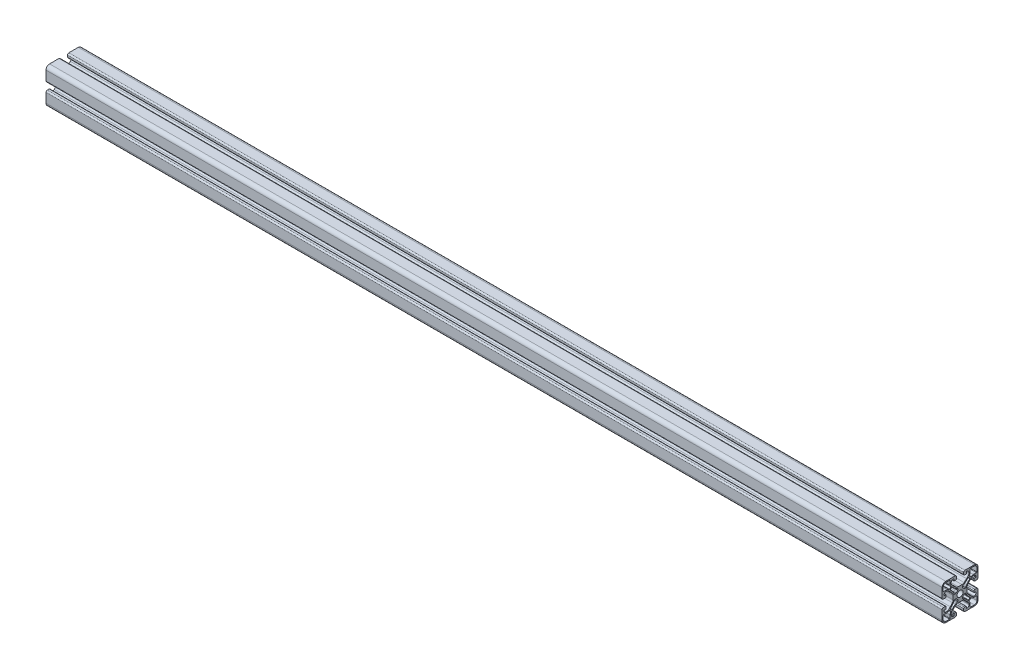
SolidWorks part; units mm, degrees
ref_plane "Ebene vorne" through (0, 0, 0) normal (0, 0, 1) x (1, 0, 0)
ref_plane "Ebene oben" through (0, 0, 0) normal (0, 1, 0) x (1, 0, 0)
ref_plane "Ebene rechts" through (0, 0, 0) normal (1, 0, 0) x (0, 0, -1)
sketch "Skizze1" plane through (0, 0, 0) normal (0, 1, 0) x (1, 0, 0)
  line L0 (0, 0) -> (1000, 0)
  dimension "D1" = 1000
other "Strukturbauteil1"
ref_plane "Ebene1" through (0, 0, 0) normal (1, 0, 0) x (0, 0, -1)
sketch "Model" plane through (0, 0, 0) normal (1, 0, 0) x (0, 0, -1)
  line L1 (0, 20) -> (-20, 20) construction
  line L2 (-20, 20) -> (-20, 0) construction
  line L4 (14.7836, 10) -> (15.5, 10)
  line L5 (17.59, 7) -> (16, 7)
  line L6 (15.5, 6.5) -> (15.5, 5)
  line L7 (16.5, 4) -> (18.5, 4)
  line L8 (20, 5.5) -> (20, 16)
  line L9 (16, 20) -> (5.5, 20)
  line L10 (4, 18.5) -> (4, 16.5)
  line L11 (5, 15.5) -> (6.5, 15.5)
  line L12 (7, 16) -> (7, 17.59)
  line L13 (10, 15.5) -> (10, 14.7836)
  line L14 (6.119, 2.5) -> (4.6098, 2.5)
  line L15 (9.5499, 10.8148) -> (10.8148, 9.5499)
  line L16 (18.8, 16) -> (18.8, 11.7)
  line L17 (18.3, 11.2) -> (14.7836, 11.2)
  line L18 (12.8543, 10.553) -> (12.4466, 10.2386)
  line L19 (11.7838, 10.2779) -> (10.2779, 11.7838)
  line L20 (10.553, 12.8543) -> (10.2386, 12.4466)
  line L21 (11.2, 14.7836) -> (11.2, 18.3)
  line L22 (11.7, 18.8) -> (16, 18.8)
  line L23 (18, 7.5) -> (18, 7.41)
  line L24 (13.5778, 9.5957) -> (10.8702, 7.2249)
  line L25 (10.8702, 7.2249) -> (8.531, 4.4899)
  line L26 (7.5, 18) -> (7.41, 18)
  line L27 (8.8303, 10.8019) -> (7.0915, 9.0992)
  line L28 (-10, 14.7836) -> (-10, 15.5)
  line L29 (-7, 17.59) -> (-7, 16)
  line L30 (-6.5, 15.5) -> (-5, 15.5)
  line L31 (-4, 16.5) -> (-4, 18.5)
  line L32 (-5.5, 20) -> (-16, 20)
  line L33 (-20, 16) -> (-20, 5.5)
  line L34 (-18.5, 4) -> (-16.5, 4)
  line L35 (-15.5, 5) -> (-15.5, 6.5)
  line L36 (-16, 7) -> (-17.59, 7)
  line L37 (-15.5, 10) -> (-14.7836, 10)
  line L38 (7.0915, 9.0992) -> (5.2023, 7.5652)
  line L39 (10.8019, 8.8303) -> (9.0992, 7.0915)
  line L40 (9.0992, 7.0915) -> (7.5652, 5.2023)
  line L41 (5.2023, 7.5652) -> (4.1197, 6.9517)
  line L42 (7.5652, 5.2023) -> (6.9517, 4.1197)
  line L43 (6.9517, 4.1197) -> (6.613, 2.9224)
  line L44 (9.5957, 13.5778) -> (7.2249, 10.8702)
  line L45 (7.2249, 10.8702) -> (4.4899, 8.531)
  line L46 (20, 0) -> (20, 20) construction
  line L47 (4.1907, 2.7273) -> (3.5355, 3.5355)
  line L48 (3.5355, 3.5355) -> (2.7273, 4.1907)
  line L49 (2.5, 4.6098) -> (2.5, 6.119)
  line L50 (4.1197, 6.9517) -> (2.9224, 6.613)
  line L51 (20, 20) -> (0, 20) construction
  line L53 (0, 20) -> (0, 0) construction
  line L54 (-2.5, 6.119) -> (-2.5, 4.6098)
  line L55 (-4.6098, 2.5) -> (-6.119, 2.5)
  line L56 (-10.8148, 9.5499) -> (-9.5499, 10.8148)
  line L57 (-16, 18.8) -> (-11.7, 18.8)
  line L58 (-11.2, 18.3) -> (-11.2, 14.7836)
  line L59 (-10.553, 12.8543) -> (-10.2386, 12.4466)
  line L60 (-10.2779, 11.7838) -> (-11.7838, 10.2779)
  line L61 (-12.8543, 10.553) -> (-12.4466, 10.2386)
  line L62 (-14.7836, 11.2) -> (-18.3, 11.2)
  line L63 (-18.8, 11.7) -> (-18.8, 16)
  line L64 (10, -14.7836) -> (10, -15.5)
  line L65 (7, -17.59) -> (7, -16)
  line L66 (6.5, -15.5) -> (5, -15.5)
  line L67 (4, -16.5) -> (4, -18.5)
  line L68 (5.5, -20) -> (16, -20)
  line L69 (20, -16) -> (20, -5.5)
  line L70 (18.5, -4) -> (16.5, -4)
  line L71 (15.5, -5) -> (15.5, -6.5)
  line L72 (16, -7) -> (17.59, -7)
  line L73 (15.5, -10) -> (14.7836, -10)
  line L74 (2.5, -6.119) -> (2.5, -4.6098)
  line L75 (10.8148, -9.5499) -> (9.5499, -10.8148)
  line L76 (16, -18.8) -> (11.7, -18.8)
  line L77 (11.2, -18.3) -> (11.2, -14.7836)
  line L78 (10.553, -12.8543) -> (10.2386, -12.4466)
  line L79 (10.2779, -11.7838) -> (11.7838, -10.2779)
  line L80 (12.8543, -10.553) -> (12.4466, -10.2386)
  line L81 (14.7836, -11.2) -> (18.3, -11.2)
  line L82 (18.8, -11.7) -> (18.8, -16)
  line L83 (7.5, -18) -> (7.41, -18)
  line L84 (-7.5, 18) -> (-7.41, 18)
  line L85 (9.5957, -13.5778) -> (7.2249, -10.8702)
  line L86 (7.2249, -10.8702) -> (4.4899, -8.531)
  line L87 (18, -7.5) -> (18, -7.41)
  line L88 (10.8019, -8.8303) -> (9.0992, -7.0915)
  line L89 (-9.5957, 13.5778) -> (-7.2249, 10.8702)
  line L90 (-7.2249, 10.8702) -> (-4.4899, 8.531)
  line L91 (-18, 7.5) -> (-18, 7.41)
  line L92 (-10.8019, 8.8303) -> (-9.0992, 7.0915)
  line L93 (-9.0992, 7.0915) -> (-7.5652, 5.2023)
  line L94 (-8.8303, 10.8019) -> (-7.0915, 9.0992)
  line L95 (-7.0915, 9.0992) -> (-5.2023, 7.5652)
  line L96 (-7.5652, 5.2023) -> (-6.9517, 4.1197)
  line L97 (-6.9517, 4.1197) -> (-6.613, 2.9224)
  line L98 (-5.2023, 7.5652) -> (-4.1197, 6.9517)
  line L99 (-4.1197, 6.9517) -> (-2.9224, 6.613)
  line L100 (-2.7273, 4.1907) -> (-3.5355, 3.5355)
  line L101 (-3.5355, 3.5355) -> (-4.1907, 2.7273)
  line L102 (-13.5778, 9.5957) -> (-10.8702, 7.2249)
  line L103 (-10.8702, 7.2249) -> (-8.531, 4.4899)
  line L104 (9.0992, -7.0915) -> (7.5652, -5.2023)
  line L105 (8.8303, -10.8019) -> (7.0915, -9.0992)
  line L106 (7.0915, -9.0992) -> (5.2023, -7.5652)
  line L107 (7.5652, -5.2023) -> (6.9517, -4.1197)
  line L108 (5.2023, -7.5652) -> (4.1197, -6.9517)
  line L109 (4.1197, -6.9517) -> (2.9224, -6.613)
  line L110 (13.5778, -9.5957) -> (10.8702, -7.2249)
  line L111 (10.8702, -7.2249) -> (8.531, -4.4899)
  line L112 (0, -20) -> (20, -20) construction
  line L113 (2.7273, -4.1907) -> (3.5355, -3.5355)
  line L114 (3.5355, -3.5355) -> (4.1907, -2.7273)
  line L115 (4.6098, -2.5) -> (6.119, -2.5)
  line L116 (6.9517, -4.1197) -> (6.613, -2.9224)
  line L117 (20, -20) -> (20, 0) construction
  line L119 (20, 0) -> (0, 0) construction
  line L120 (-14.7836, -10) -> (-15.5, -10)
  line L121 (-17.59, -7) -> (-16, -7)
  line L122 (-15.5, -6.5) -> (-15.5, -5)
  line L123 (-16.5, -4) -> (-18.5, -4)
  line L124 (-20, -5.5) -> (-20, -16)
  line L125 (-16, -20) -> (-5.5, -20)
  line L126 (-4, -18.5) -> (-4, -16.5)
  line L127 (-5, -15.5) -> (-6.5, -15.5)
  line L128 (-7, -16) -> (-7, -17.59)
  line L129 (-10, -15.5) -> (-10, -14.7836)
  line L130 (-6.119, -2.5) -> (-4.6098, -2.5)
  line L131 (-9.5499, -10.8148) -> (-10.8148, -9.5499)
  line L132 (-18.8, -16) -> (-18.8, -11.7)
  line L133 (-18.3, -11.2) -> (-14.7836, -11.2)
  line L134 (-12.8543, -10.553) -> (-12.4466, -10.2386)
  line L135 (-11.7838, -10.2779) -> (-10.2779, -11.7838)
  line L136 (-10.553, -12.8543) -> (-10.2386, -12.4466)
  line L137 (-11.2, -14.7836) -> (-11.2, -18.3)
  line L138 (-11.7, -18.8) -> (-16, -18.8)
  line L139 (-18, -7.5) -> (-18, -7.41)
  line L140 (-13.5778, -9.5957) -> (-10.8702, -7.2249)
  line L141 (-10.8702, -7.2249) -> (-8.531, -4.4899)
  line L142 (-7.5, -18) -> (-7.41, -18)
  line L143 (-8.8303, -10.8019) -> (-7.0915, -9.0992)
  line L144 (-7.0915, -9.0992) -> (-5.2023, -7.5652)
  line L145 (-10.8019, -8.8303) -> (-9.0992, -7.0915)
  line L146 (-9.0992, -7.0915) -> (-7.5652, -5.2023)
  line L147 (-5.2023, -7.5652) -> (-4.1197, -6.9517)
  line L148 (-7.5652, -5.2023) -> (-6.9517, -4.1197)
  line L149 (-6.9517, -4.1197) -> (-6.613, -2.9224)
  line L150 (-9.5957, -13.5778) -> (-7.2249, -10.8702)
  line L151 (-7.2249, -10.8702) -> (-4.4899, -8.531)
  line L152 (-20, 0) -> (-20, -20) construction
  line L153 (-4.1907, -2.7273) -> (-3.5355, -3.5355)
  line L154 (-3.5355, -3.5355) -> (-2.7273, -4.1907)
  line L155 (-2.5, -4.6098) -> (-2.5, -6.119)
  line L156 (-4.1197, -6.9517) -> (-2.9224, -6.613)
  line L157 (-20, -20) -> (0, -20) construction
  line L158 (0, 0) -> (-20, 0) construction
  line L159 (0, -20) -> (0, 0) construction
  line L160 (-2.1156, 7.75) -> (2.1156, 7.75)
  line L161 (7.75, 2.1156) -> (7.75, -2.1156)
  line L162 (2.1156, -7.75) -> (-2.1156, -7.75)
  line L163 (-7.75, -2.1156) -> (-7.75, 2.1156)
  circle A0 centre (0, 0) radius 3.4
  arc A1 (8.531, 4.4899) -> (7.75, 2.1156) centre (11.75, 2.1156) ccw
  arc A2 (7.41, 18) -> (7, 17.59) centre (7.41, 17.59) ccw
  arc A3 (14.7836, 10) -> (13.5778, 9.5957) centre (14.7836, 8) ccw
  arc A4 (18, 7.5) -> (15.5, 10) centre (15.5, 7.5) ccw
  arc A5 (16, 7) -> (15.5, 6.5) centre (16, 6.5) ccw
  arc A6 (15.5, 5) -> (16.5, 4) centre (16.5, 5) ccw
  arc A7 (18.5, 4) -> (20, 5.5) centre (18.5, 5.5) ccw
  arc A8 (20, 16) -> (16, 20) centre (16, 16) ccw
  arc A9 (5.5, 20) -> (4, 18.5) centre (5.5, 18.5) ccw
  arc A10 (4, 16.5) -> (5, 15.5) centre (5, 16.5) ccw
  arc A11 (6.5, 15.5) -> (7, 16) centre (6.5, 16) ccw
  arc A12 (10, 15.5) -> (7.5, 18) centre (7.5, 15.5) ccw
  arc A13 (9.5957, 13.5778) -> (10, 14.7836) centre (8, 14.7836) ccw
  arc A14 (6.119, 2.5) -> (6.613, 2.9224) centre (6.119, 3) ccw
  arc A15 (4.1907, 2.7273) -> (4.6098, 2.5) centre (4.6098, 3) ccw
  arc A16 (9.5499, 10.8148) -> (8.8303, 10.8019) centre (9.1963, 10.4612) ccw
  arc A17 (10.8019, 8.8303) -> (10.8148, 9.5499) centre (10.4612, 9.1963) ccw
  arc A18 (18.8, 16) -> (16, 18.8) centre (16, 16) ccw
  arc A19 (18.3, 11.2) -> (18.8, 11.7) centre (18.3, 11.7) ccw
  arc A20 (14.7836, 11.2) -> (12.8543, 10.553) centre (14.7836, 8) ccw
  arc A21 (11.7838, 10.2779) -> (12.4466, 10.2386) centre (12.1374, 10.6315) ccw
  arc A22 (10.2386, 12.4466) -> (10.2779, 11.7838) centre (10.6315, 12.1374) ccw
  arc A23 (10.553, 12.8543) -> (11.2, 14.7836) centre (8, 14.7836) ccw
  arc A24 (11.7, 18.8) -> (11.2, 18.3) centre (11.7, 18.3) ccw
  arc A25 (18, 7.41) -> (17.59, 7) centre (17.59, 7.41) cw
  arc A26 (2.5, 4.6098) -> (2.7273, 4.1907) centre (3, 4.6098) ccw
  arc A27 (2.9224, 6.613) -> (2.5, 6.119) centre (3, 6.119) ccw
  arc A28 (2.1156, 7.75) -> (4.4899, 8.531) centre (2.1156, 11.75) ccw
  arc A29 (4.4899, -8.531) -> (2.1156, -7.75) centre (2.1156, -11.75) ccw
  arc A30 (18, -7.41) -> (17.59, -7) centre (17.59, -7.41) ccw
  arc A31 (10, -14.7836) -> (9.5957, -13.5778) centre (8, -14.7836) ccw
  arc A32 (7.5, -18) -> (10, -15.5) centre (7.5, -15.5) ccw
  arc A33 (7, -16) -> (6.5, -15.5) centre (6.5, -16) ccw
  arc A34 (5, -15.5) -> (4, -16.5) centre (5, -16.5) ccw
  arc A35 (4, -18.5) -> (5.5, -20) centre (5.5, -18.5) ccw
  arc A36 (16, -20) -> (20, -16) centre (16, -16) ccw
  arc A37 (20, -5.5) -> (18.5, -4) centre (18.5, -5.5) ccw
  arc A38 (16.5, -4) -> (15.5, -5) centre (16.5, -5) ccw
  arc A39 (15.5, -6.5) -> (16, -7) centre (16, -6.5) ccw
  arc A40 (15.5, -10) -> (18, -7.5) centre (15.5, -7.5) ccw
  arc A41 (13.5778, -9.5957) -> (14.7836, -10) centre (14.7836, -8) ccw
  arc A42 (2.5, -6.119) -> (2.9224, -6.613) centre (3, -6.119) ccw
  arc A43 (-4.4899, 8.531) -> (-2.1156, 7.75) centre (-2.1156, 11.75) ccw
  arc A44 (-18, 7.41) -> (-17.59, 7) centre (-17.59, 7.41) ccw
  arc A45 (-10, 14.7836) -> (-9.5957, 13.5778) centre (-8, 14.7836) ccw
  arc A46 (-7.5, 18) -> (-10, 15.5) centre (-7.5, 15.5) ccw
  arc A47 (2.7273, -4.1907) -> (2.5, -4.6098) centre (3, -4.6098) ccw
  arc A48 (-7, 16) -> (-6.5, 15.5) centre (-6.5, 16) ccw
  arc A49 (-5, 15.5) -> (-4, 16.5) centre (-5, 16.5) ccw
  arc A50 (-4, 18.5) -> (-5.5, 20) centre (-5.5, 18.5) ccw
  arc A51 (-16, 20) -> (-20, 16) centre (-16, 16) ccw
  arc A52 (-20, 5.5) -> (-18.5, 4) centre (-18.5, 5.5) ccw
  arc A53 (-16.5, 4) -> (-15.5, 5) centre (-16.5, 5) ccw
  arc A54 (-15.5, 6.5) -> (-16, 7) centre (-16, 6.5) ccw
  arc A55 (10.8148, -9.5499) -> (10.8019, -8.8303) centre (10.4612, -9.1963) ccw
  arc A56 (-15.5, 10) -> (-18, 7.5) centre (-15.5, 7.5) ccw
  arc A57 (-13.5778, 9.5957) -> (-14.7836, 10) centre (-14.7836, 8) ccw
  arc A58 (8.8303, -10.8019) -> (9.5499, -10.8148) centre (9.1963, -10.4612) ccw
  arc A59 (-7.75, 2.1156) -> (-8.531, 4.4899) centre (-11.75, 2.1156) ccw
  arc A60 (16, -18.8) -> (18.8, -16) centre (16, -16) ccw
  arc A61 (11.2, -18.3) -> (11.7, -18.8) centre (11.7, -18.3) ccw
  arc A62 (11.2, -14.7836) -> (10.553, -12.8543) centre (8, -14.7836) ccw
  arc A63 (10.2779, -11.7838) -> (10.2386, -12.4466) centre (10.6315, -12.1374) ccw
  arc A64 (12.4466, -10.2386) -> (11.7838, -10.2779) centre (12.1374, -10.6315) ccw
  arc A65 (12.8543, -10.553) -> (14.7836, -11.2) centre (14.7836, -8) ccw
  arc A66 (18.8, -11.7) -> (18.3, -11.2) centre (18.3, -11.7) ccw
  arc A67 (7.41, -18) -> (7, -17.59) centre (7.41, -17.59) cw
  arc A68 (4.6098, -2.5) -> (4.1907, -2.7273) centre (4.6098, -3) ccw
  arc A69 (6.613, -2.9224) -> (6.119, -2.5) centre (6.119, -3) ccw
  arc A70 (7.75, -2.1156) -> (8.531, -4.4899) centre (11.75, -2.1156) ccw
  arc A71 (-8.531, -4.4899) -> (-7.75, -2.1156) centre (-11.75, -2.1156) ccw
  arc A72 (-7.41, -18) -> (-7, -17.59) centre (-7.41, -17.59) ccw
  arc A73 (-14.7836, -10) -> (-13.5778, -9.5957) centre (-14.7836, -8) ccw
  arc A74 (-18, -7.5) -> (-15.5, -10) centre (-15.5, -7.5) ccw
  arc A75 (-16, -7) -> (-15.5, -6.5) centre (-16, -6.5) ccw
  arc A76 (-15.5, -5) -> (-16.5, -4) centre (-16.5, -5) ccw
  arc A77 (-18.5, -4) -> (-20, -5.5) centre (-18.5, -5.5) ccw
  arc A78 (-20, -16) -> (-16, -20) centre (-16, -16) ccw
  arc A79 (-5.5, -20) -> (-4, -18.5) centre (-5.5, -18.5) ccw
  arc A80 (-4, -16.5) -> (-5, -15.5) centre (-5, -16.5) ccw
  arc A81 (-6.5, -15.5) -> (-7, -16) centre (-6.5, -16) ccw
  arc A82 (-10, -15.5) -> (-7.5, -18) centre (-7.5, -15.5) ccw
  arc A83 (-9.5957, -13.5778) -> (-10, -14.7836) centre (-8, -14.7836) ccw
  arc A84 (-6.119, -2.5) -> (-6.613, -2.9224) centre (-6.119, -3) ccw
  arc A85 (-4.1907, -2.7273) -> (-4.6098, -2.5) centre (-4.6098, -3) ccw
  arc A86 (-9.5499, -10.8148) -> (-8.8303, -10.8019) centre (-9.1963, -10.4612) ccw
  arc A87 (-10.8019, -8.8303) -> (-10.8148, -9.5499) centre (-10.4612, -9.1963) ccw
  arc A88 (-2.5, 6.119) -> (-2.9224, 6.613) centre (-3, 6.119) ccw
  arc A89 (-2.7273, 4.1907) -> (-2.5, 4.6098) centre (-3, 4.6098) ccw
  arc A90 (-18.8, -16) -> (-16, -18.8) centre (-16, -16) ccw
  arc A91 (-4.6098, 2.5) -> (-4.1907, 2.7273) centre (-4.6098, 3) ccw
  arc A92 (-6.613, 2.9224) -> (-6.119, 2.5) centre (-6.119, 3) ccw
  arc A93 (-18.3, -11.2) -> (-18.8, -11.7) centre (-18.3, -11.7) ccw
  arc A94 (-14.7836, -11.2) -> (-12.8543, -10.553) centre (-14.7836, -8) ccw
  arc A95 (-10.8148, 9.5499) -> (-10.8019, 8.8303) centre (-10.4612, 9.1963) ccw
  arc A96 (-8.8303, 10.8019) -> (-9.5499, 10.8148) centre (-9.1963, 10.4612) ccw
  arc A97 (-11.7838, -10.2779) -> (-12.4466, -10.2386) centre (-12.1374, -10.6315) ccw
  arc A98 (-16, 18.8) -> (-18.8, 16) centre (-16, 16) ccw
  arc A99 (-11.2, 18.3) -> (-11.7, 18.8) centre (-11.7, 18.3) ccw
  arc A100 (-11.2, 14.7836) -> (-10.553, 12.8543) centre (-8, 14.7836) ccw
  arc A101 (-10.2779, 11.7838) -> (-10.2386, 12.4466) centre (-10.6315, 12.1374) ccw
  arc A102 (-12.4466, 10.2386) -> (-11.7838, 10.2779) centre (-12.1374, 10.6315) ccw
  arc A103 (-12.8543, 10.553) -> (-14.7836, 11.2) centre (-14.7836, 8) ccw
  arc A104 (-18.8, 11.7) -> (-18.3, 11.2) centre (-18.3, 11.7) ccw
  arc A105 (-10.2386, -12.4466) -> (-10.2779, -11.7838) centre (-10.6315, -12.1374) ccw
  arc A106 (-10.553, -12.8543) -> (-11.2, -14.7836) centre (-8, -14.7836) ccw
  arc A107 (-11.7, -18.8) -> (-11.2, -18.3) centre (-11.7, -18.3) ccw
  arc A108 (-18, -7.41) -> (-17.59, -7) centre (-17.59, -7.41) cw
  arc A109 (-2.5, -4.6098) -> (-2.7273, -4.1907) centre (-3, -4.6098) ccw
  arc A110 (-2.9224, -6.613) -> (-2.5, -6.119) centre (-3, -6.119) ccw
  arc A111 (-2.1156, -7.75) -> (-4.4899, -8.531) centre (-2.1156, -11.75) ccw
  arc A141 (-7.41, 18) -> (-7, 17.59) centre (-7.41, 17.59) cw
  point P2 (0, 0)
  point P377 (0, 0)
  dimension "D1" = 4
  dimension "D2" = 40
  dimension "D3" = 40
